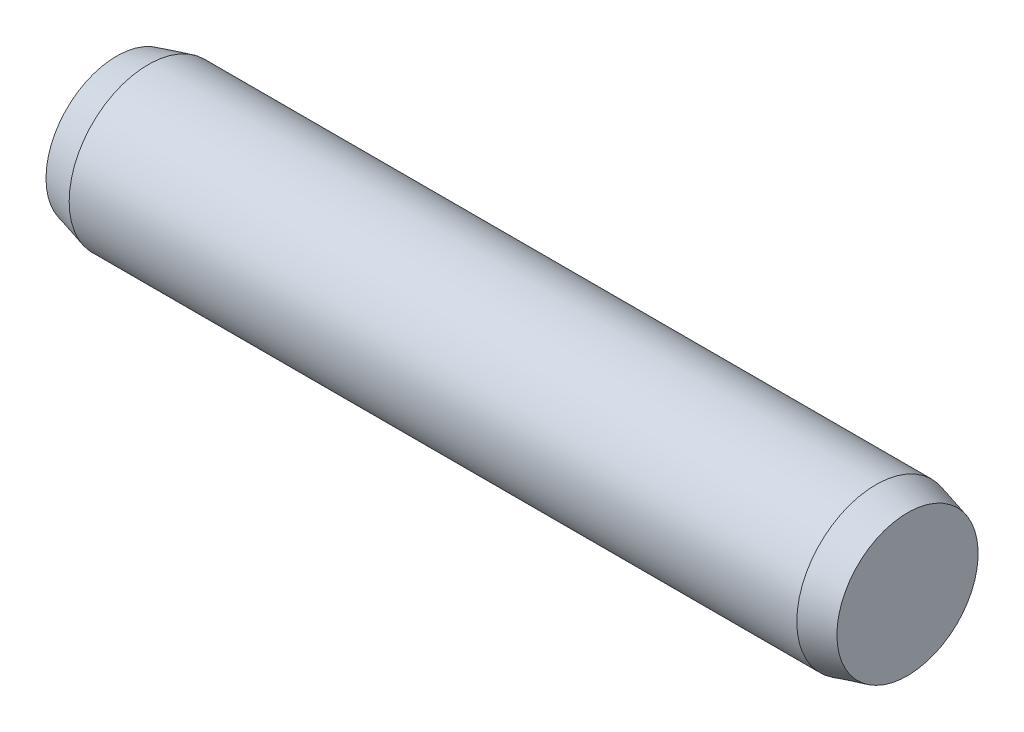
SolidWorks part; units mm, degrees
ref_plane "Plane1" through (0, 0, 0) normal (0, 0, 1) x (1, 0, 0)
ref_plane "Plane2" through (0, 0, 0) normal (0, 1, 0) x (1, 0, 0)
ref_plane "Plane3" through (0, 0, 0) normal (1, 0, 0) x (0, 0, -1)
sketch "Sketch1" plane through (0, 0, 0) normal (0, 0, 1) x (1, 0, 0)
  line L1 (-6.35, 0) -> (107.95, 0) construction
  line L2 (0, 0) -> (40, 0)
  line L3 (40, 0) -> (40, 3.5713)
  line L4 (40, 3.5713) -> (38.4, 4)
  line L5 (38.4, 4) -> (1.6, 4)
  line L6 (0, 3.5713) -> (0, 0)
  line L7 (0, 3.5713) -> (1.6, 4)
revolve "Base-Revolve" add sketch "Sketch1" angle 360 about L1
equation "\"D3@Sketch1\" = 15.0"
equation "\"D1@Sketch1\" = \"Chamfer_len@Sketch1\""
equation "\"D2@Sketch1\" = \"D3@Sketch1\""
